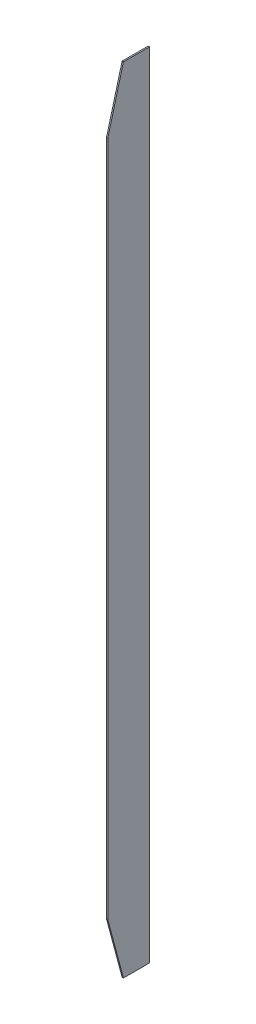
SolidWorks part; units mm, degrees
ref_plane "Front Plane" through (0, 0, 0) normal (1, 0, 0) x (0, 1, 0)
ref_plane "Top Plane" through (0, 0, 0) normal (0, 0, 1) x (0, 1, 0)
ref_plane "Right Plane" through (0, 0, 0) normal (0, 1, 0) x (-1, 0, 0)
sketch "Sketch1" plane through (0, 0, 0) normal (1, 0, 0) x (0, 1, 0)
  line L104 (-2790.2559, 3772.5462) -> (-2592.7237, 3035.3458)
  line L105 (-2592.7237, 3035.3458) -> (-1660.4121, 3285.1579)
  line L106 (-1660.4121, 3285.1579) -> (-1920.1483, 4254.5069)
  line L107 (-2691.4898, 3403.946) -> (-831.7735, 3902.2555)
  line L108 (-831.7735, 3902.2555) -> (-1019.1396, 4601.5151)
  point P2 (-1857.9443, 4022.3583)
  point P7 (-930.5396, 4270.8556)
  line B0 (-2911.1385, 3815.8883) -> (-2910.3497, 3812.9441)
  line B1 (-0.1749, 4595.8786) -> (-2911.1385, 3815.8883)
  line B2 (-2790.2559, 3769.3906) -> (-0.1749, 4516.9906)
  line B3 (-0.1749, 4592.7231) -> (-2910.3497, 3812.9441)
  line B4 (-2790.2559, 3772.5462) -> (-0.1749, 4520.1461)
  line B5 (-2790.2559, 3772.5462) -> (-2790.2559, 3769.3906)
  line B6 (-0.1749, 4592.7231) -> (-0.1749, 4595.8786)
  line B7 (-0.1749, 4516.9906) -> (-0.1749, 4520.1461)
  line B8 (-2911.1385, 3815.8883) -> (-2910.3497, 3812.9441)
  line B9 (-0.1749, 4595.8786) -> (-2911.1385, 3815.8883)
  line B10 (-2790.2559, 3769.3906) -> (-0.1749, 4516.9906)
  line B11 (-0.1749, 4592.7231) -> (-2910.3497, 3812.9441)
  line B12 (-2790.2559, 3772.5462) -> (-0.1749, 4520.1461)
  line B13 (-2790.2559, 3772.5462) -> (-2790.2559, 3769.3906)
  line B14 (-0.1749, 4592.7231) -> (-0.1749, 4595.8786)
  line B15 (-0.1749, 4516.9906) -> (-0.1749, 4520.1461)
  line B16 (-2791.7419, 3670.3) -> (-2791.7419, 3797.3)
  line B17 (-2804.4419, 3810) -> (-2931.4419, 3810)
  line B18 (-2944.1419, 3797.3) -> (-2944.1419, 3670.3)
  line B19 (-2931.4419, 3657.6) -> (-2804.4419, 3657.6)
  line B20 (-2931.4419, 3663.95) -> (-2804.4419, 3663.95)
  line B21 (-2798.0919, 3670.3) -> (-2798.0919, 3797.3)
  line B22 (-2804.4419, 3803.65) -> (-2931.4419, 3803.65)
  line B23 (-2937.7919, 3797.3) -> (-2937.7919, 3670.3)
  line B24 (-2911.1385, 3815.8883) -> (-2910.3497, 3812.9441)
  line B25 (-0.1749, 4595.8786) -> (-2911.1385, 3815.8883)
  line B26 (-2790.2559, 3769.3906) -> (-0.1749, 4516.9906)
  line B27 (-0.1749, 4592.7231) -> (-2910.3497, 3812.9441)
  line B28 (-2790.2559, 3772.5462) -> (-0.1749, 4520.1461)
  line B29 (-2790.2559, 3772.5462) -> (-2790.2559, 3769.3906)
  line B30 (-0.1749, 4592.7231) -> (-0.1749, 4595.8786)
  line B31 (-0.1749, 4516.9906) -> (-0.1749, 4520.1461)
  line B32 (-1619.6889, 4163.5747) -> (-2944.5528, 3808.5785)
  line B33 (-0.4109, 4597.4589) -> (-147.618, 4558.0149)
  line B34 (-1619.2781, 4162.0413) -> (-2944.1419, 3807.0451)
  line B35 (0, 4595.9255) -> (-147.2071, 4556.4815)
  line B36 (-2944.5528, 3808.5785) -> (-2944.1419, 3807.0451)
  line B37 (0, 4595.9255) -> (-0.4109, 4597.4589)
  line B38 (-147.2071, 4556.4815) -> (-1619.2781, 4162.0413)
  line B39 (-147.618, 4558.0149) -> (-1619.6889, 4163.5747)
  line B40 (2910.3497, 3812.9441) -> (2911.1385, 3815.8883)
  line B41 (2911.1385, 3815.8883) -> (0.1749, 4595.8786)
  line B42 (0.1749, 4516.9906) -> (2790.2559, 3769.3906)
  line B43 (2910.3497, 3812.9441) -> (0.1749, 4592.7231)
  line B44 (0.1749, 4520.1461) -> (2790.2559, 3772.5462)
  line B45 (2790.2559, 3769.3906) -> (2790.2559, 3772.5462)
  line B46 (0.1749, 4520.1461) -> (0.1749, 4516.9906)
  line B47 (0.1749, 4595.8786) -> (0.1749, 4592.7231)
  line B48 (2910.3497, 3812.9441) -> (2911.1385, 3815.8883)
  line B49 (2911.1385, 3815.8883) -> (0.1749, 4595.8786)
  line B50 (0.1749, 4516.9906) -> (2790.2559, 3769.3906)
  line B51 (2910.3497, 3812.9441) -> (0.1749, 4592.7231)
  line B52 (0.1749, 4520.1461) -> (2790.2559, 3772.5462)
  line B53 (2790.2559, 3769.3906) -> (2790.2559, 3772.5462)
  line B54 (0.1749, 4520.1461) -> (0.1749, 4516.9906)
  line B55 (0.1749, 4595.8786) -> (0.1749, 4592.7231)
  line B56 (2910.3497, 3812.9441) -> (2911.1385, 3815.8883)
  line B57 (2911.1385, 3815.8883) -> (0.1749, 4595.8786)
  line B58 (0.1749, 4516.9906) -> (2790.2559, 3769.3906)
  line B59 (2910.3497, 3812.9441) -> (0.1749, 4592.7231)
  line B60 (0.1749, 4520.1461) -> (2790.2559, 3772.5462)
  line B61 (2790.2559, 3769.3906) -> (2790.2559, 3772.5462)
  line B62 (0.1749, 4520.1461) -> (0.1749, 4516.9906)
  line B63 (0.1749, 4595.8786) -> (0.1749, 4592.7231)
  line B64 (1619.2781, 4162.0413) -> (2944.1419, 3807.0451)
  line B65 (0, 4595.9255) -> (147.2071, 4556.4815)
  line B66 (1619.6889, 4163.5747) -> (2944.5528, 3808.5785)
  line B67 (0.4109, 4597.4589) -> (147.618, 4558.0149)
  line B68 (2944.1419, 3807.0451) -> (2944.5528, 3808.5785)
  line B69 (0.4109, 4597.4589) -> (0, 4595.9255)
  line B70 (147.618, 4558.0149) -> (1619.6889, 4163.5747)
  line B71 (147.2071, 4556.4815) -> (1619.2781, 4162.0413)
  line B72 (2791.7419, 3797.3) -> (2791.7419, 3670.3)
  line B73 (2804.4419, 3657.6) -> (2931.4419, 3657.6)
  line B74 (2944.1419, 3670.3) -> (2944.1419, 3797.3)
  line B75 (2931.4419, 3810) -> (2804.4419, 3810)
  line B76 (2931.4419, 3803.65) -> (2804.4419, 3803.65)
  line B77 (2798.0919, 3797.3) -> (2798.0919, 3670.3)
  line B78 (2804.4419, 3663.95) -> (2931.4419, 3663.95)
  line B79 (2937.7919, 3670.3) -> (2937.7919, 3797.3)
  arc B80 (-2791.7419, 3797.3) -> (-2804.4419, 3810) centre (-2804.4419, 3797.3) ccw
  arc B81 (-2931.4419, 3810) -> (-2944.1419, 3797.3) centre (-2931.4419, 3797.3) ccw
  arc B82 (-2944.1419, 3670.3) -> (-2931.4419, 3657.6) centre (-2931.4419, 3670.3) ccw
  arc B83 (-2804.4419, 3657.6) -> (-2791.7419, 3670.3) centre (-2804.4419, 3670.3) ccw
  arc B84 (-2937.7919, 3670.3) -> (-2931.4419, 3663.95) centre (-2931.4419, 3670.3) ccw
  arc B85 (-2804.4419, 3663.95) -> (-2798.0919, 3670.3) centre (-2804.4419, 3670.3) ccw
  arc B86 (-2798.0919, 3797.3) -> (-2804.4419, 3803.65) centre (-2804.4419, 3797.3) ccw
  arc B87 (-2931.4419, 3803.65) -> (-2937.7919, 3797.3) centre (-2931.4419, 3797.3) ccw
  arc B88 (2791.7419, 3670.3) -> (2804.4419, 3657.6) centre (2804.4419, 3670.3) ccw
  arc B89 (2931.4419, 3657.6) -> (2944.1419, 3670.3) centre (2931.4419, 3670.3) ccw
  arc B90 (2944.1419, 3797.3) -> (2931.4419, 3810) centre (2931.4419, 3797.3) ccw
  arc B91 (2804.4419, 3810) -> (2791.7419, 3797.3) centre (2804.4419, 3797.3) ccw
  arc B92 (2937.7919, 3797.3) -> (2931.4419, 3803.65) centre (2931.4419, 3797.3) ccw
  arc B93 (2804.4419, 3803.65) -> (2798.0919, 3797.3) centre (2804.4419, 3797.3) ccw
  arc B94 (2798.0919, 3670.3) -> (2804.4419, 3663.95) centre (2804.4419, 3670.3) ccw
  arc B95 (2931.4419, 3663.95) -> (2937.7919, 3670.3) centre (2931.4419, 3670.3) ccw
  line B96 (2101.6408, 3993.3485) -> (2111.5018, 4030.1503)
  line B97 (2108.435, 4030.9721) -> (2098.574, 3994.1703)
  line B98 (2108.435, 4030.9721) -> (2111.5018, 4030.1503)
  line B99 (2098.574, 3994.1703) -> (2101.6408, 3993.3485)
  line B100 (-2111.5018, 4030.1503) -> (-2101.6408, 3993.3485)
  line B101 (-2098.574, 3994.1703) -> (-2108.435, 4030.9721)
  line B102 (-2098.574, 3994.1703) -> (-2101.6408, 3993.3485)
  line B103 (-2108.435, 4030.9721) -> (-2111.5018, 4030.1503)
  line B104 (-2931.4419, 3657.6) -> (-2804.4419, 3657.6)
  line B105 (-2791.7419, 3670.3) -> (-2791.7419, 3797.3)
  line B106 (-2804.4419, 3810) -> (-2931.4419, 3810)
  line B107 (-2944.1419, 3797.3) -> (-2944.1419, 3670.3)
  line B108 (-2931.4419, 3663.95) -> (-2804.4419, 3663.95)
  line B109 (-2798.0919, 3670.3) -> (-2798.0919, 3797.3)
  line B110 (-2804.4419, 3803.65) -> (-2931.4419, 3803.65)
  line B111 (-2937.7919, 3797.3) -> (-2937.7919, 3670.3)
  line B112 (-2937.7919, 3657.6) -> (-2944.1419, 3657.6)
  line B113 (-2791.7419, 3657.6) -> (-2798.0919, 3657.6)
  line B114 (-2791.7419, 0) -> (-2791.7419, 3657.6)
  line B115 (-2944.1419, 3657.6) -> (-2944.1419, 0)
  line B116 (-2798.0919, 0) -> (-2798.0919, 3657.6)
  line B117 (-2937.7919, 3657.6) -> (-2937.7919, 0)
  line B118 (-2798.0919, 0) -> (-2791.7419, 0)
  line B119 (-2944.1419, 0) -> (-2937.7919, 0)
  line B120 (-1375.4663, 4227.3704) -> (-1365.6053, 4190.5686)
  line B121 (-1362.5385, 4191.3904) -> (-1372.3995, 4228.1922)
  line B122 (-1362.5385, 4191.3904) -> (-1365.6053, 4190.5686)
  line B123 (-1372.3995, 4228.1922) -> (-1375.4663, 4227.3704)
  line B124 (-1619.6889, 4163.5747) -> (-2944.5528, 3808.5785)
  line B125 (-0.4109, 4597.4589) -> (-147.618, 4558.0149)
  line B126 (-1619.2781, 4162.0413) -> (-2944.1419, 3807.0451)
  line B127 (0, 4595.9255) -> (-147.2071, 4556.4815)
  line B128 (-2944.5528, 3808.5785) -> (-2944.1419, 3807.0451)
  line B129 (0, 4595.9255) -> (-0.4109, 4597.4589)
  line B130 (-147.2071, 4556.4815) -> (-1619.2781, 4162.0413)
  line B131 (-147.618, 4558.0149) -> (-1619.6889, 4163.5747)
  line B132 (-639.4308, 4424.5905) -> (-629.5698, 4387.7888)
  line B133 (-626.503, 4388.6105) -> (-636.364, 4425.4123)
  line B134 (-626.503, 4388.6105) -> (-629.5698, 4387.7888)
  line B135 (-636.364, 4425.4123) -> (-639.4308, 4424.5905)
  line B136 (1365.6053, 4190.5686) -> (1375.4663, 4227.3704)
  line B137 (1372.3995, 4228.1922) -> (1362.5385, 4191.3904)
  line B138 (1372.3995, 4228.1922) -> (1375.4663, 4227.3704)
  line B139 (1362.5385, 4191.3904) -> (1365.6053, 4190.5686)
  line B140 (2798.0919, 3657.6) -> (2791.7419, 3657.6)
  line B141 (2944.1419, 3657.6) -> (2937.7919, 3657.6)
  line B142 (2791.7419, 3657.6) -> (2791.7419, 0)
  line B143 (2944.1419, 0) -> (2944.1419, 3657.6)
  line B144 (2798.0919, 3657.6) -> (2798.0919, 0)
  line B145 (2937.7919, 0) -> (2937.7919, 3657.6)
  line B146 (2937.7919, 0) -> (2944.1419, 0)
  line B147 (2791.7419, 0) -> (2798.0919, 0)
  line B148 (1619.2781, 4162.0413) -> (2944.1419, 3807.0451)
  line B149 (0, 4595.9255) -> (147.2071, 4556.4815)
  line B150 (1619.6889, 4163.5747) -> (2944.5528, 3808.5785)
  line B151 (0.4109, 4597.4589) -> (147.618, 4558.0149)
  line B152 (2944.1419, 3807.0451) -> (2944.5528, 3808.5785)
  line B153 (0.4109, 4597.4589) -> (0, 4595.9255)
  line B154 (147.618, 4558.0149) -> (1619.6889, 4163.5747)
  line B155 (147.2071, 4556.4815) -> (1619.2781, 4162.0413)
  line B156 (2931.4419, 3810) -> (2804.4419, 3810)
  line B157 (2791.7419, 3797.3) -> (2791.7419, 3670.3)
  line B158 (2804.4419, 3657.6) -> (2931.4419, 3657.6)
  line B159 (2944.1419, 3670.3) -> (2944.1419, 3797.3)
  line B160 (2931.4419, 3803.65) -> (2804.4419, 3803.65)
  line B161 (2798.0919, 3797.3) -> (2798.0919, 3670.3)
  line B162 (2804.4419, 3663.95) -> (2931.4419, 3663.95)
  line B163 (2937.7919, 3670.3) -> (2937.7919, 3797.3)
  line B164 (629.5698, 4387.7888) -> (639.4308, 4424.5905)
  line B165 (636.364, 4425.4123) -> (626.503, 4388.6105)
  line B166 (636.364, 4425.4123) -> (639.4308, 4424.5905)
  line B167 (626.503, 4388.6105) -> (629.5698, 4387.7888)
  arc B168 (-2944.1419, 3670.3) -> (-2931.4419, 3657.6) centre (-2931.4419, 3670.3) ccw
  arc B169 (-2804.4419, 3657.6) -> (-2791.7419, 3670.3) centre (-2804.4419, 3670.3) ccw
  arc B170 (-2791.7419, 3797.3) -> (-2804.4419, 3810) centre (-2804.4419, 3797.3) ccw
  arc B171 (-2931.4419, 3810) -> (-2944.1419, 3797.3) centre (-2931.4419, 3797.3) ccw
  arc B172 (-2937.7919, 3670.3) -> (-2931.4419, 3663.95) centre (-2931.4419, 3670.3) ccw
  arc B173 (-2804.4419, 3663.95) -> (-2798.0919, 3670.3) centre (-2804.4419, 3670.3) ccw
  arc B174 (-2798.0919, 3797.3) -> (-2804.4419, 3803.65) centre (-2804.4419, 3797.3) ccw
  arc B175 (-2931.4419, 3803.65) -> (-2937.7919, 3797.3) centre (-2931.4419, 3797.3) ccw
  arc B176 (2944.1419, 3797.3) -> (2931.4419, 3810) centre (2931.4419, 3797.3) ccw
  arc B177 (2804.4419, 3810) -> (2791.7419, 3797.3) centre (2804.4419, 3797.3) ccw
  arc B178 (2791.7419, 3670.3) -> (2804.4419, 3657.6) centre (2804.4419, 3670.3) ccw
  arc B179 (2931.4419, 3657.6) -> (2944.1419, 3670.3) centre (2931.4419, 3670.3) ccw
  arc B180 (2937.7919, 3797.3) -> (2931.4419, 3803.65) centre (2931.4419, 3797.3) ccw
  arc B181 (2804.4419, 3803.65) -> (2798.0919, 3797.3) centre (2804.4419, 3797.3) ccw
  arc B182 (2798.0919, 3670.3) -> (2804.4419, 3663.95) centre (2804.4419, 3670.3) ccw
  arc B183 (2931.4419, 3663.95) -> (2937.7919, 3670.3) centre (2931.4419, 3670.3) ccw
  dimension "D1" = 965.2
  dimension "D2" = 1925.32
sketch_block_instance "Mid roof-1"
sketch_block "Mid roof"
sketch_block_instance "Off ctr-1"
sketch_block "Off ctr"
sketch "Sketch2" plane through (0, 0, 0) normal (1, 0, 0) x (0, 1, 0)
  line L0 (-1891.8201, 4022.3583) -> (1959.3689, 4022.3583)
  line L1 (-1891.8201, 4022.3583) -> (-1891.8201, 4085.8583)
  line L2 (-1891.8201, 4085.8583) -> (-1560.0408, 4174.7583)
  line L3 (-0.1749, 4592.7231) -> (-2910.3497, 3812.9441) construction
  line L5 (-1560.0408, 4174.7583) -> (1627.5895, 4174.7583)
  line L6 (1959.3689, 4022.3583) -> (1959.3689, 4085.8583)
  line L7 (1959.3689, 4085.8583) -> (1627.5895, 4174.7583)
  dimension "D1" = 63.5
  dimension "D2" = 15
  dimension "D3" = 152.4
  dimension "D4" = 15
extrude "Boss-Extrude1" [suppressed] add sketch "Sketch2" along normal mid plane 3.175
sketch "Sketch3" plane through (0, 0, 0) normal (1, 0, 0) x (0, 1, 0)
  line L0 (-964.4154, 4270.8556) -> (964.4154, 4270.8556)
  line L1 (-964.4154, 4270.8556) -> (-964.4154, 4334.3556)
  line L2 (-964.4154, 4334.3556) -> (-822.2243, 4372.4556)
  line L3 (-822.2243, 4372.4556) -> (822.2243, 4372.4556)
  line L4 (822.2243, 4372.4556) -> (964.4154, 4334.3556)
  line L5 (964.4154, 4334.3556) -> (964.4154, 4270.8556)
  line L6 (-0.1749, 4592.7231) -> (-2910.3497, 3812.9441) construction
  line L7 (2910.3497, 3812.9441) -> (0.1749, 4592.7231) construction
  dimension "D1" = 63.5
  dimension "D2" = 15
  dimension "D3" = 15
  dimension "D4" = 101.6
extrude "Boss-Extrude2" add sketch "Sketch3" along normal mid plane 3.175
